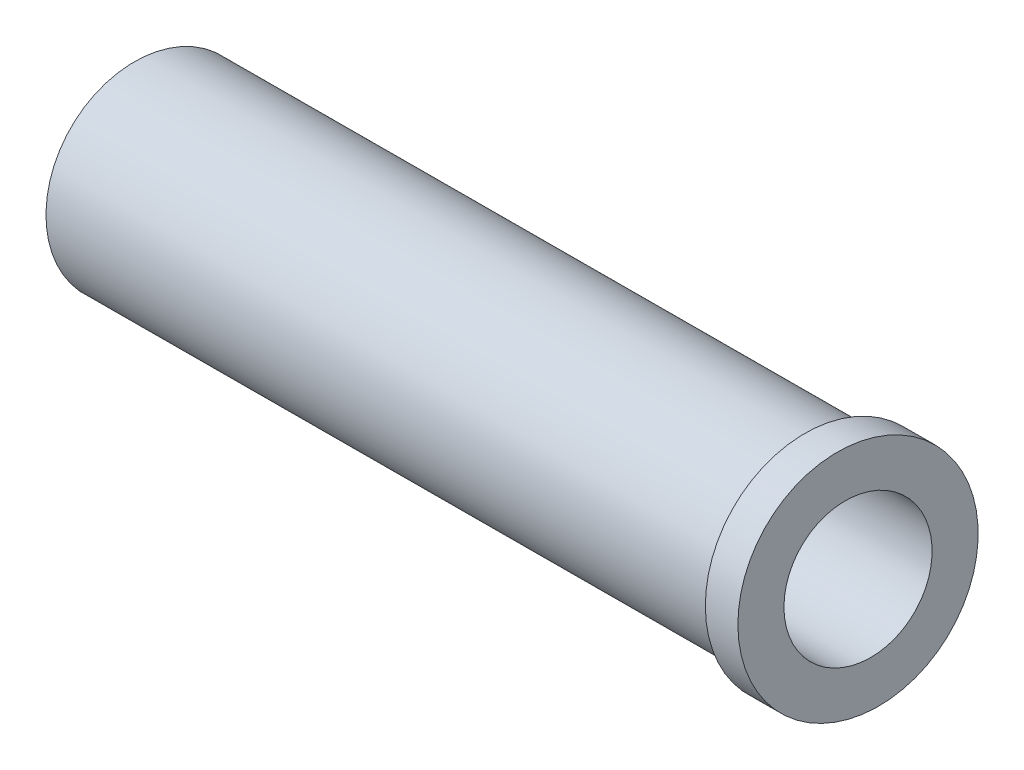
SolidWorks part; units mm, degrees
ref_plane "Alzado" through (0, 0, 0) normal (0, 0, 1) x (1, 0, 0)
ref_plane "Planta" through (0, 0, 0) normal (0, 1, 0) x (1, 0, 0)
ref_plane "Vista lateral" through (0, 0, 0) normal (1, 0, 0) x (0, 0, -1)
sketch3d "Sk_Puno"
  line L0 (250.774, 39.9286, -26.4554) -> (379.4801, 26.798, -39.196)
  dimension "D1" = 130
sweep "Puno" add path "Sk_Puno" parameters "D3"=32
sketch3d "Sk_Collarin"
  line L0 (250.774, 39.9286, -26.4554) -> (256.7143, 39.3226, -27.0434)
  dimension "D1" = 6
sweep "Collarin" add path "Sk_Collarin" parameters "D3"=36
sketch3d "Sk_Agujero_puno"
  line L0 (249.7839, 40.0296, -26.3574) -> (377.5, 27, -39)
  dimension "D1" = 129
sweep "Agujero_puno" cut path "Sk_Agujero_puno" parameters "D3"=22.2
mirror "Simetria_lado_izq" about plane through (0, 0, 0) normal (1, 0, 0)
delete or keep bodies "Borrar_original_dcho" type delete bodies bodies 103
